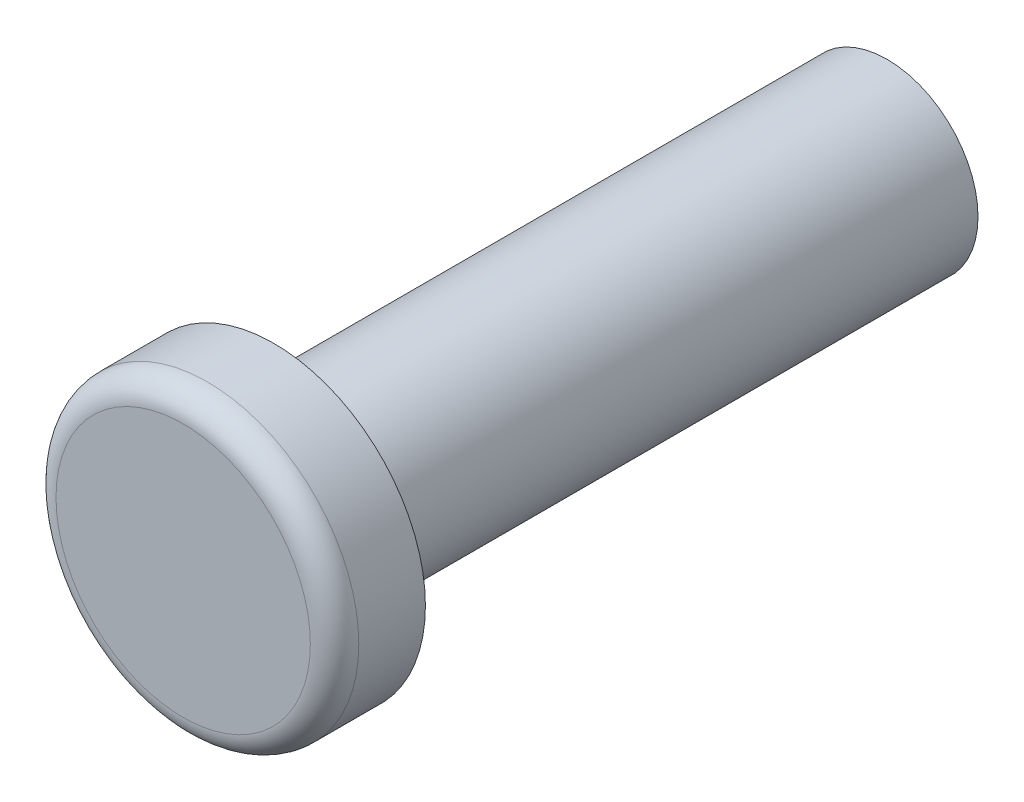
SolidWorks part; units mm, degrees
ref_plane "Спереди" through (0, 0, 0) normal (0, 0, 1) x (1, 0, 0)
ref_plane "Сверху" through (0, 0, 0) normal (0, 1, 0) x (1, 0, 0)
ref_plane "Справа" through (0, 0, 0) normal (1, 0, 0) x (0, 0, -1)
sketch "Эскиз3" plane through (0, 0, 0) normal (0, 0, 1) x (1, 0, 0)
  circle A0 centre (0, 0) radius 5
  dimension "D1" = 10
extrude "Бобышка-Вытянуть1" add sketch "Эскиз3" along normal blind 3
sketch "Эскиз4" plane through (0, 0, 0) normal (0, 0, -1) x (-1, 0, 0)
  circle A0 centre (0, 0) radius 3
  dimension "D1" = 6
extrude "Бобышка-Вытянуть2" add sketch "Эскиз4" along normal blind 20.25
fillet "Скругление1" radius 0.8 1 edges at (5, 0, 3)
